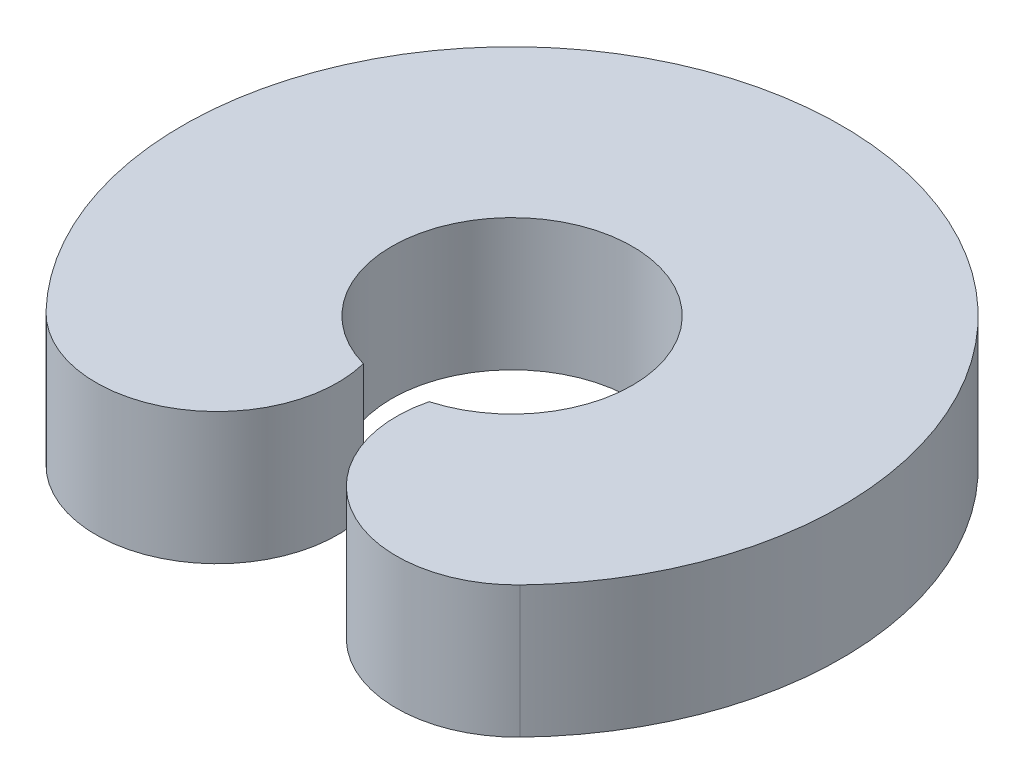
SolidWorks part; units mm, degrees
ref_plane "前视基准面" through (0, 0, 0) normal (0, 0, 1) x (1, 0, 0)
ref_plane "上视基准面" through (0, 0, 0) normal (0, 1, 0) x (1, 0, 0)
ref_plane "右视基准面" through (0, 0, 0) normal (1, 0, 0) x (0, 0, -1)
sketch "草图1" plane through (0, 0, 0) normal (0, 1, 0) x (1, 0, 0)
  line L0 (0, 0) -> (0, 475) construction
  line L1 (0, 0) -> (539.5049, -520.9938) construction
  line L2 (0, 0) -> (-539.5049, -520.9938) construction
  line L3 (0, 475) -> (-137.5, 236.843) construction
  line L4 (0, 475) -> (137.5, 236.843) construction
  line L5 (0, 0) -> (790.1582, 0) construction
  line L6 (0, 475) -> (0, 750) construction
  circle A0 centre (0, 0) radius 475 construction
  circle A1 centre (0, 475) radius 275 construction
  arc A2 (74.8551, -263.4342) -> (-74.8551, -263.4342) centre (0, 0) ccw
  arc A3 (539.5049, -520.9938) -> (-539.5049, -520.9938) centre (0, 0) ccw
  arc A4 (-539.5049, -520.9938) -> (-74.8551, -263.4342) centre (-341.6864, -329.9627) ccw
  arc A5 (74.8551, -263.4342) -> (539.5049, -520.9938) centre (341.6864, -329.9627) ccw
  dimension "D1" = 950
  dimension "D2" = 550
  dimension "D3" = 150
  dimension "D4" = 150
  dimension "D5" = 134
  dimension "D6" = 134
extrude "凸台-拉伸1" add sketch "草图1" along normal blind 300
